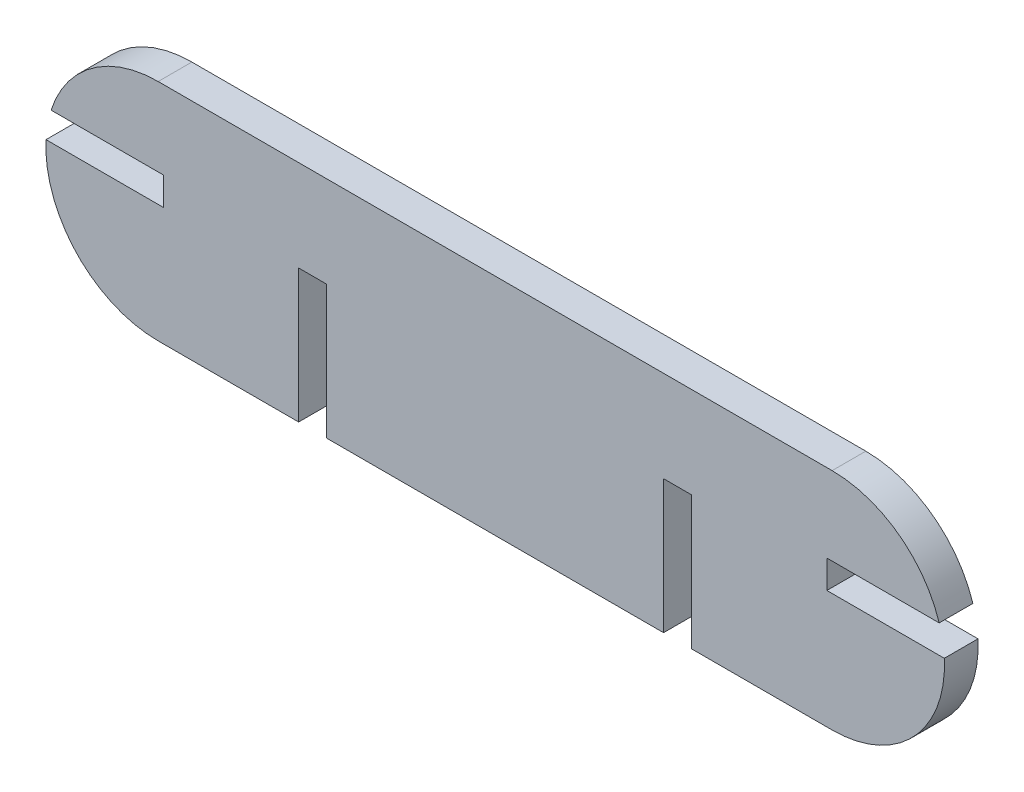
SolidWorks part; units mm, degrees
ref_plane "Front Plane" through (0, 0, 0) normal (0, 0, 1) x (1, 0, 0)
ref_plane "Top Plane" through (0, 0, 0) normal (0, 1, 0) x (1, 0, 0)
ref_plane "Right Plane" through (0, 0, 0) normal (1, 0, 0) x (0, 0, -1)
sketch "Sketch1" plane through (0, 0, 0) normal (0, 0, 1) x (1, 0, 0)
  line L0 (0, -1000) -> (0, 49000) construction
  line L1 (-30, 8.225) -> (30, 8.225)
  line L2 (-17.4936, 0.1) -> (-17.4936, -11.775)
  line L3 (-30, -11.775) -> (-17.4936, -11.775)
  line L4 (17.4936, -11.775) -> (30, -11.775)
  line L5 (-14.9936, 0.1) -> (-17.4936, 0.1)
  line L6 (-14.9936, 0.1) -> (-14.9936, -11.775)
  line L7 (14.9936, 0.1) -> (17.4936, 0.1)
  line L8 (-14.9936, -11.775) -> (14.9936, -11.775)
  line L9 (-1000, 0) -> (49000, 0) construction
  line L10 (39.9862, -1.25) -> (29.5315, -1.25)
  line L11 (-39.5315, 1.25) -> (-29.5315, 1.25)
  line L12 (29.5315, 1.25) -> (29.5315, -1.25)
  line L13 (-39.9862, -1.25) -> (-29.5315, -1.25)
  line L14 (14.9936, 0.1) -> (14.9936, -11.775)
  line L15 (-29.5315, 1.25) -> (-29.5315, -1.25)
  line L16 (17.4936, 0.1) -> (17.4936, -11.775)
  line L17 (14.9936, 0.1) -> (17.4936, -11.775) construction
  line L18 (14.9936, -11.775) -> (17.4936, 0.1) construction
  line L19 (39.5315, 1.25) -> (29.5315, 1.25)
  arc A0 (30, -11.775) -> (39.9862, -1.25) centre (30, -1.775) ccw
  arc A1 (-30, 8.225) -> (-39.5315, 1.25) centre (-30, -1.775) ccw
  arc A2 (-39.9862, -1.25) -> (-30, -11.775) centre (-30, -1.775) ccw
  arc A3 (39.5315, 1.25) -> (30, 8.225) centre (30, -1.775) ccw
  point P0 (0, 0)
  point P14 (16.2436, -5.8375)
extrude "Boss-Extrude1" add sketch "Sketch1" along normal blind 3
equation "\"D2@Sketch1\"=\"D1@Sketch1\"/3"
